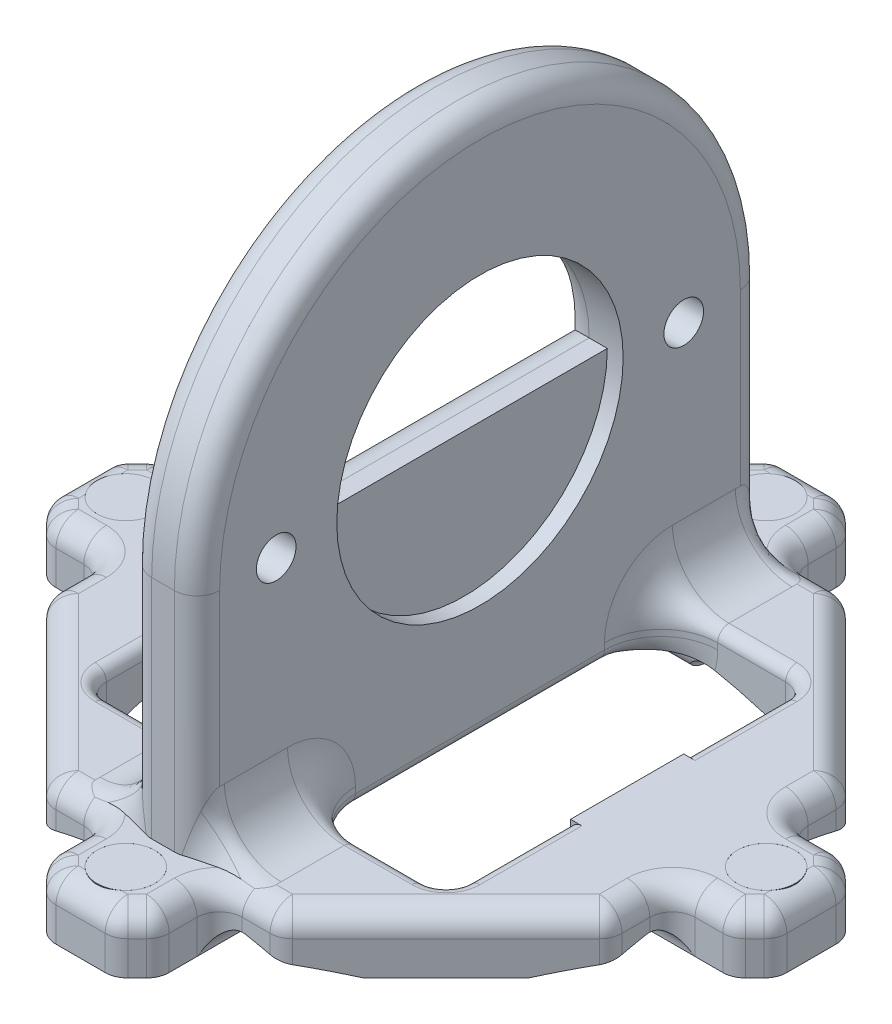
SolidWorks part; units mm, degrees
ref_plane "Front Plane" through (0, 0, 0) normal (0, 0, 1) x (1, 0, 0)
ref_plane "Top Plane" through (0, 0, 0) normal (0, 1, 0) x (1, 0, 0)
ref_plane "Right Plane" through (0, 0, 0) normal (1, 0, 0) x (0, 0, -1)
sketch "Sketch1" plane through (0, 0, 0) normal (0, 1, 0) x (1, 0, 0)
  line L1 (-23, -25) -> (23, -25)
  line L2 (-25, -23) -> (-25, 23)
  line L3 (-23, 25) -> (23, 25)
  line L4 (25, -23) -> (25, 23)
  line L5 (-25, -25) -> (25, 25) construction
  line L6 (-25, 25) -> (25, -25) construction
  line L7 (14, 16) -> (-14, 16)
  line L8 (16, 14) -> (16, -14)
  line L9 (14, -16) -> (-14, -16)
  line L10 (-16, 14) -> (-16, -14)
  line L11 (16, 16) -> (-16, -16) construction
  line L12 (16, -16) -> (-16, 16) construction
  arc A0 (-23, -25) -> (-25, -23) centre (-23, -23) cw
  arc A1 (23, -25) -> (25, -23) centre (23, -23) ccw
  arc A2 (23, 25) -> (25, 23) centre (23, 23) cw
  arc A3 (-25, 23) -> (-23, 25) centre (-23, 23) cw
  circle A4 centre (-20, 20) radius 2.55
  circle A5 centre (20, 20) radius 2.55
  circle A6 centre (20, -20) radius 2.55
  circle A7 centre (-20, -20) radius 2.55
  arc A8 (14, 16) -> (16, 14) centre (14, 14) cw
  arc A9 (16, -14) -> (14, -16) centre (14, -14) cw
  arc A10 (-14, -16) -> (-16, -14) centre (-14, -14) cw
  arc A11 (-14, 16) -> (-16, 14) centre (-14, 14) ccw
  point P0 (0, 0)
  point P26 (0, 0)
  dimension "D3" = 2
  dimension "D8" = 5.1
  dimension "D11" = 2
  dimension "D1" = 50
  dimension "D2" = 50
  dimension "D4" = 5
  dimension "D5" = 5
  dimension "D6" = 5
  dimension "D7" = 5
  dimension "D9" = 32
  dimension "D10" = 32
extrude "Boss-Extrude1" add sketch "Sketch1" along normal blind 5
sketch "Sketch3" plane through (0, 5, 0) normal (0, 1, 0) x (1, 0, 0)
  circle A0 centre (-20, 20) radius 3
  circle A1 centre (20, 20) radius 3
  circle A2 centre (20, -20) radius 3
  circle A3 centre (-20, -20) radius 3
  dimension "D1" = 6
extrude "Boss-Extrude3" add sketch "Sketch3" against normal blind 1.5
sketch "Sketch4" plane through (0, 5, 0) normal (0, 1, 0) x (1, 0, 0)
  line L1 (3, -25) -> (-3, -25)
  line L2 (3, -25) -> (3, 25)
  line L3 (3, 25) -> (-3, 25)
  line L4 (-3, -25) -> (-3, 25)
  line L5 (3, -25) -> (-3, 25) construction
  line L6 (3, 25) -> (-3, -25) construction
  line L7 (-23, -25) -> (23, -25) construction
  point P0 (0, 0)
  dimension "D1" = 6
extrude "Boss-Extrude4" add sketch "Sketch4" against normal up to surface (5 mm away)
sketch "Sketch5" plane through (0, 5, 0) normal (0, 1, 0) x (1, 0, 0)
  line L0 (3, -16) -> (3, 16) construction
  line L1 (-3, -25) -> (3, -25)
  line L2 (-3, -25) -> (-3, 25)
  line L3 (-3, 25) -> (3, 25)
  line L4 (3, -25) -> (3, 25)
  line L5 (-3, -25) -> (3, 25) construction
  line L6 (-3, 25) -> (3, -25) construction
  line L7 (-23, -25) -> (23, -25) construction
  point P0 (0, 0)
extrude "Boss-Extrude5" add sketch "Sketch5" along normal blind 20
sketch "Sketch6" plane through (3, 0, 0) normal (1, 0, 0) x (0, 0, -1)
  line L0 (-25, 25) -> (25, 25) construction
  line L1 (-25, 25) -> (-12.65, 25)
  line L2 (12.65, 25) -> (25, 25)
  arc A0 (12.65, 25) -> (-12.65, 25) centre (0, 25) ccw
  arc A1 (25, 25) -> (-25, 25) centre (0, 25) ccw
  dimension "D1" = 25.3
extrude "Boss-Extrude6" add sketch "Sketch6" against normal up to surface (6 mm away)
sketch "Sketch7" plane through (3, 0, 0) normal (1, 0, 0) x (0, 0, -1)
  line L0 (-12.65, 25) -> (12.65, 25) construction
  circle A0 centre (0, 25) radius 12.65
  dimension "D1" = 25.3
extrude "Cut-Extrude1" cut sketch "Sketch7" against normal blind 1.4
sketch "Sketch8" plane through (0, 0, 25) normal (0, 0, 1) x (1, 0, 0)
  line L0 (3, 5) -> (23, 5) construction
  line L1 (-14, 0) -> (14, 0)
  arc A0 (-14, 0) -> (14, 0) centre (0, -37.95) cw
  point P3 (0, 2.5)
  dimension "D1" = 2.5
extrude "Cut-Extrude2" cut sketch "Sketch8" against normal through all
fillet "Fillet1" radius 2 16 edges at (13, 5, -25) (24.4142, 5, -24.4142) (25, 5, 0) (24.4142, 5, 24.4142) (-13, 5, -25) (-24.4142, 5, -24.4142) (-25, 5, 0) (-24.4142, 5, 24.4142) (-3, 15, -25) (-3, 15, 25) (3, 15, -25) (3, 50, 0) (13, 5, 25) (-13, 5, 25) (-3, 50, 0) (3, 15, 25)
fillet "Fillet3" radius 1 12 edges at (-8.5, 5, -16) (-15.4142, 5, -15.4142) (-8.5, 5, 16) (-15.4142, 5, 15.4142) (8.5, 5, -16) (15.4142, 5, -15.4142) (16, 5, 0) (15.4142, 5, 15.4142) (-3, 2.3886, 0) (3, 2.3886, 0) (-16, 5, 0) (8.5, 5, 16)
sketch "Sketch9" plane through (25, 0, 0) normal (1, 0, 0) x (0, 0, -1)
  line L0 (-23, 5) -> (23, 5) construction
  line L1 (-14, 0) -> (14, 0)
  arc A0 (-14, 0) -> (14, 0) centre (0, -37.95) cw
  point P7 (0, 2.5)
  dimension "D1" = 2.5
extrude "Cut-Extrude3" cut sketch "Sketch9" against normal through all
fillet "Fillet4" radius 5 20 edges at (2.6898, 2.7278, -16) (3, 3.7259, -16) (3, 4.7071, -16.2929) (2.4142, 4.4142, -24.4142) (-2.4142, 4.4142, -24.4142) (-2.6898, 2.7278, -16) (-3, 3.7259, -16) (-3, 4.7071, -16.2929) (-2.6898, 2.7278, 16) (-3, 3.7259, 16) (-3, 4.7071, 16.2929) (-2.4142, 4.4142, 24.4142) (2.4142, 4.4142, 24.4142) (2.6898, 2.7278, 16) (3, 3.7259, 16) (3, 4.7071, 16.2929) (3, 5, -20) (-3, 5, -20) (-3, 5, 20) (3, 5, 20)
sketch "Sketch10" plane through (3, 0, 0) normal (1, 0, 0) x (0, 0, -1)
  line L0 (18, 25) -> (-18, 25) construction
  line L2 (25, 25) -> (23, 25) construction
  circle A0 centre (-18, 25) radius 1.75
  circle A1 centre (18, 25) radius 1.75
  point P3 (0, 25)
  dimension "D2" = 3.5
  dimension "D1" = 36
extrude "Cut-Extrude4" cut sketch "Sketch10" against normal through all
fillet "Fillet5" radius 3 2 edges at (-3, 37.65, 0) (-3, 25, 0)
sketch "Sketch11" plane through (0, 0, 0) normal (0, -1, 0) x (1, 0, 0)
  line L0 (0, -28.2843) -> (-28.2843, 0) construction
  line L1 (-20, -20) -> (20, -20) construction
  line L2 (-20, -20) -> (-20, 20) construction
  line L3 (-20, 20) -> (20, 20) construction
  line L4 (0, -28.2843) -> (28.2843, 0) construction
  line L9 (-28.2843, 0) -> (0, 28.2843) construction
  line L22 (20, -20) -> (20, 20) construction
  line L23 (-20, -20) -> (20, 20) construction
  line L24 (-20, 20) -> (20, -20) construction
  line L25 (28.2843, 0) -> (0, 28.2843) construction
  line L26 (0, -28.2843) -> (0, 28.2843) construction
  line L27 (-28.2843, 0) -> (28.2843, 0) construction
  line L28 (-16, -14) -> (-16, 14) construction
  line L29 (-16, -5) -> (-30.2843, -5)
  line L30 (-16, -5) -> (-16, 5)
  line L31 (-16, 5) -> (-30.2843, 5)
  line L32 (-32.2843, -3) -> (-32.2843, 3)
  line L33 (-5, 16) -> (5, 16)
  line L34 (-5, 16) -> (-5, 30.2843)
  line L35 (-3, 32.2843) -> (3, 32.2843)
  line L36 (5, 16) -> (5, 30.2843)
  line L37 (16, 5) -> (16, -5)
  line L38 (16, 5) -> (30.2843, 5)
  line L39 (32.2843, 3) -> (32.2843, -3)
  line L40 (16, -5) -> (30.2843, -5)
  line L41 (5, -16) -> (-5, -16)
  line L42 (5, -16) -> (5, -30.2843)
  line L43 (3, -32.2843) -> (-3, -32.2843)
  line L44 (-5, -16) -> (-5, -30.2843)
  circle A6 centre (0, 28.2843) radius 2.55
  circle A7 centre (28.2843, 0) radius 2.55
  circle A8 centre (0, -28.2843) radius 2.55
  circle A9 centre (-28.2843, 0) radius 2.55
  circle A11 centre (0, 0) radius 3 construction
  arc A13 (-30.2843, -5) -> (-32.2843, -3) centre (-30.2843, -3) cw
  arc A14 (-30.2843, 5) -> (-32.2843, 3) centre (-30.2843, 3) ccw
  arc A15 (-5, 30.2843) -> (-3, 32.2843) centre (-3, 30.2843) cw
  arc A16 (5, 30.2843) -> (3, 32.2843) centre (3, 30.2843) ccw
  arc A17 (30.2843, 5) -> (32.2843, 3) centre (30.2843, 3) cw
  arc A18 (30.2843, -5) -> (32.2843, -3) centre (30.2843, -3) ccw
  arc A19 (5, -30.2843) -> (3, -32.2843) centre (3, -30.2843) cw
  arc A20 (-5, -30.2843) -> (-3, -32.2843) centre (-3, -30.2843) ccw
  point P0 (0, 0)
  point P3 (0, 0)
  point P20 (-32.2843, 0)
  point P22 (0, 0)
  point P44 (0, 0)
  point P61 (0, 0)
  dimension "D1" = 40
  dimension "D2" = 5.1
  dimension "D3" = 10
  dimension "D5" = 2
  dimension "D4" = 4
  dimension "D6" = 4
extrude "Boss-Extrude7" add sketch "Sketch11" against normal up to surface (5 mm away)
sketch "Sketch12" plane through (0, 5, 0) normal (0, 1, 0) x (1, 0, 0)
  circle A0 centre (-28.2843, 0) radius 2.55
  circle A1 centre (0, 28.2843) radius 2.55
  circle A2 centre (28.2843, 0) radius 2.55
  circle A3 centre (0, -28.2843) radius 2.55
  dimension "D1" = 5.1
extrude "Boss-Extrude8" add sketch "Sketch12" against normal blind 1.5 separate body
sketch "Sketch13" plane through (0, 5, 0) normal (0, 1, 0) x (1, 0, 0)
  line L0 (-32.2843, -3) -> (-3, -32.2843)
  line L1 (-3, -32.2843) -> (3, -32.2843)
  line L2 (3, -32.2843) -> (32.2843, -3)
  line L3 (32.2843, -3) -> (32.2843, 3)
  line L4 (32.2843, 3) -> (3, 32.2843)
  line L5 (3, 32.2843) -> (-3, 32.2843)
  line L6 (-3, 32.2843) -> (-32.2843, 3)
  line L7 (-32.2843, 3) -> (-32.2843, -3)
  line L8 (-57.2843, 13.3553) -> (-57.2843, -13.3553)
  line L9 (-57.2843, -13.3553) -> (-13.3553, -57.2843)
  line L10 (-13.3553, -57.2843) -> (13.3553, -57.2843)
  line L11 (13.3553, -57.2843) -> (57.2843, -13.3553)
  line L12 (57.2843, -13.3553) -> (57.2843, 13.3553)
  line L13 (57.2843, 13.3553) -> (13.3553, 57.2843)
  line L14 (13.3553, 57.2843) -> (-13.3553, 57.2843)
  line L15 (-13.3553, 57.2843) -> (-57.2843, 13.3553)
  dimension "D1" = 25
extrude "Cut-Extrude5" cut sketch "Sketch13" against normal through all
fillet "Fillet8" radius 2 59 edges at (-5, 3.5989, 24.9082) (5, 3.5989, 24.9082) (25, 2.5949, 5) (25, 2.5949, -5) (25, 2.0854, -10.2843) (24.4142, 4.4142, -10.8701) (10.2843, 2.0854, -25) (10.8701, 4.4142, -24.4142) (5, 3.5989, -24.9082) (-5, 2.5949, -25) (-5, 3.5989, -24.9082) (-25, 2.5949, 5) (-10.2843, 2.0854, -25) (-10.8701, 4.4142, -24.4142) (-25, 2.0854, -10.2843) (-24.4142, 4.4142, -10.8701) (-25, 2.5949, -5) (-25, 2.0854, 10.2843) (-24.4142, 4.4142, 10.8701) (-10.2843, 2.0854, 25) (-10.8701, 4.4142, 24.4142) (-20.5, 2.1898, 5) (-5, 2.1898, 20.5) (-5, 2.5949, 25) (-3, 2.5, 32.2843) (-5, 2.5, 30.2843) (3, 2.5, 32.2843) (5, 2.5, 30.2843) (5, 2.5949, 25) (5, 2.1898, 20.5) (20.5, 2.1898, 5) (24.4142, 4.4142, 5) (30.2843, 2.5, 5) (32.2843, 2.5, 3) (32.2843, 2.5, -3) (30.2843, 2.5, -5) (24.4142, 4.4142, -5) (20.5, 2.1898, -5) (5, 2.1898, -20.5) (17.6421, 5, -17.6421) (5, 2.5949, -25) (3, 2.5, -32.2843) (5, 2.5, -30.2843) (-3, 2.5, -32.2843) (-5, 2.5, -30.2843) (-5, 2.1898, -20.5) (-24.4142, 4.4142, 5) (-17.6421, 5, -17.6421) (-20.5, 2.1898, -5) (-24.4142, 4.4142, -5) (-30.2843, 2.5, -5) (-32.2843, 2.5, -3) (-32.2843, 2.5, 3) (-30.2843, 2.5, 5) (-17.6421, 5, 17.6421)
fillet "Fillet9" radius 2 44 edges at (25.4641, 5, 5.1787) (27.96, 5, 5) (30.2212, 5, 4.8478) (31.2843, 5, 4) (32.132, 5, 2.9369) (25.4641, 5, -5.1787) (27.96, 5, -5) (30.2212, 5, -4.8478) (31.2843, 5, -4) (32.132, 5, -2.9369) (-5.1787, 5, 25.4641) (-5, 5, 27.96) (-4.8478, 5, 30.2212) (-4, 5, 31.2843) (-2.9369, 5, 32.132) (5.1787, 5, 25.4641) (5, 5, 27.96) (4.8478, 5, 30.2212) (4, 5, 31.2843) (2.9369, 5, 32.132) (-25.4641, 5, -5.1787) (-27.96, 5, -5) (-30.2212, 5, -4.8478) (-31.2843, 5, -4) (-32.132, 5, -2.9369) (-25.4641, 5, 5.1787) (-27.96, 5, 5) (-30.2212, 5, 4.8478) (-31.2843, 5, 4) (-32.132, 5, 2.9369) (5.1787, 5, -25.4641) (5, 5, -27.96) (4.8478, 5, -30.2212) (4, 5, -31.2843) (2.9369, 5, -32.132) (-5.1787, 5, -25.4641) (-5, 5, -27.96) (-4.8478, 5, -30.2212) (-4, 5, -31.2843) (-2.9369, 5, -32.132) (32.2843, 5, 0) (0, 5, 32.2843) (-32.2843, 5, 0) (0, 5, -32.2843)
fillet "Fillet10" radius 2 4 edges at (-16, 0, 0) (0, 0, 16) (0, 0, -16) (16, 0, 0)
fillet "Fillet11" radius 2 5 edges at (10.2843, 2.0854, 25) (10.8701, 4.4142, 24.4142) (25, 2.0854, 10.2843) (24.4142, 4.4142, 10.8701) (17.6421, 5, 17.6421)
